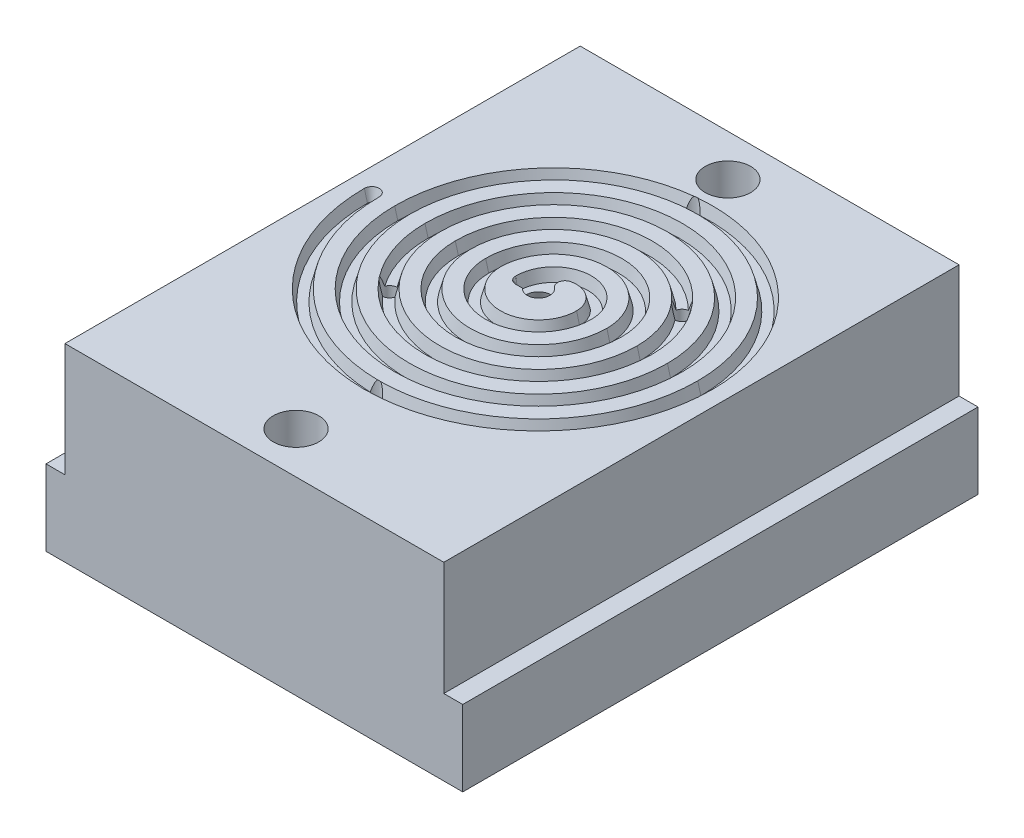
SolidWorks part; units mm, degrees
ref_plane "Plan de face" through (0, 0, 0) normal (0, 0, 1) x (1, 0, 0)
ref_plane "Plan de dessus" through (0, 0, 0) normal (0, 1, 0) x (1, 0, 0)
ref_plane "Plan de droite" through (0, 0, 0) normal (1, 0, 0) x (0, 0, -1)
imported_body "Importée3"
sketch "Esquisse1" plane through (0, 0, 0) normal (0, 0, -1) x (-1, 0, 0)
  line L0 (25, 25) -> (25, 10)
  line L1 (25, 10) -> (27.5, 10)
  line L2 (27.5, 10) -> (27.5, 25)
  line L3 (27.5, 25) -> (25, 25)
extrude "Enlèv. mat.-Extru.1" cut sketch "Esquisse1" against normal through all
sketch "Esquisse2" plane through (0, 0, 0) normal (0, 0, -1) x (-1, 0, 0)
  line L0 (-27.5, 10) -> (-25, 10)
  line L1 (-25, 10) -> (-25, 25)
  line L2 (-25, 25) -> (-27.5, 25)
  line L3 (-27.5, 25) -> (-27.5, 10)
extrude "Enlèv. mat.-Extru.2" cut sketch "Esquisse2" against normal through all
draft "Dépouille1" type of draft neutral plane draft angle 15 faces to draft 22 parameters "D1"=15
ref_plane "Plan1" through (0, 0, 30.5) normal (0, 0, 1) x (1, 0, 0)
sketch "Esquisse3" plane through (0, 0, 30.5) normal (0, 0, 1) x (1, 0, 0)
  line L0 (1.5, 25) -> (0, 25)
  line L1 (0, 25) -> (0, 0)
  line L2 (0, 0) -> (3, 0)
  line L3 (3, 0) -> (3, 10)
  line L4 (3, 10) -> (1.5, 10)
  line L5 (1.5, 10) -> (1.5, 22.5)
  line L6 (1.5, 22.5) -> (1.9, 22.5)
  line L7 (1.9, 22.5) -> (1.5, 24.0385)
  line L8 (1.5, 24.0385) -> (1.5, 25)
  line L9 (0, 25) -> (0, 0) construction
revolve "Enlèvement de matière-Révolution1" cut sketch "Esquisse3" angle 360 about L9
hole_wizard "Diamètre du perçage Ø6.0 (6)1" positions "Esquisse5" profile "Esquisse4" hole size "Ø6.0" standard "Ansi Metric"
sketch "Esquisse5" plane through (0, 25, 0) normal (0, 1, 0) x (1, 0, 0)
  point P0 (0, -5.5)
  point P1 (0, -62.5)
sketch "Esquisse4" plane through (0, 25, 5.5) normal (1, 0, 0) x (0, 0, 1)
  line L0 (0, 0) -> (0, 25)
  line L1 (0, 25) -> (3, 25)
  line L2 (3, 25) -> (3, 0)
  line L5 (3, 0) -> (0, 0)
  line L11 (0, -6.35) -> (0, 107.95) construction
  dimension "Diamètre du perçage jusqu'au prochain" = 6
  dimension "Profondeur du perçage jusqu'au prochain" = 25
hole_wizard "Diamètre du perçage Ø2.0 (2)1" positions "Esquisse7" profile "Esquisse6" hole size "Ø2.0" standard "Ansi Metric"
sketch "Esquisse7" plane through (0, 0, 0) normal (0, -1, 0) x (-1, 0, 0)
  point P0 (0, -10.6003)
  point P1 (0, -52.5)
  point P2 (11, -39.1603)
  point P3 (-11, -22.5627)
sketch "Esquisse6" plane through (0, 0, 10.6003) normal (1, 0, 0) x (0, 0, -1)
  line L0 (0, 0) -> (0, 25)
  line L1 (0, 25) -> (1, 25)
  line L2 (1, 25) -> (1, 0)
  line L5 (1, 0) -> (0, 0)
  line L11 (0, -6.35) -> (0, 107.95) construction
  dimension "Diamètre du perçage jusqu'au prochain" = 2
  dimension "Profondeur du perçage jusqu'au prochain" = 25
chamfer "Chanfrein1" distance 0.5 angle 45 1 edges at (0, 0, 27.5)
fillet "Congé variable1" radius 0.5755 1 edges
